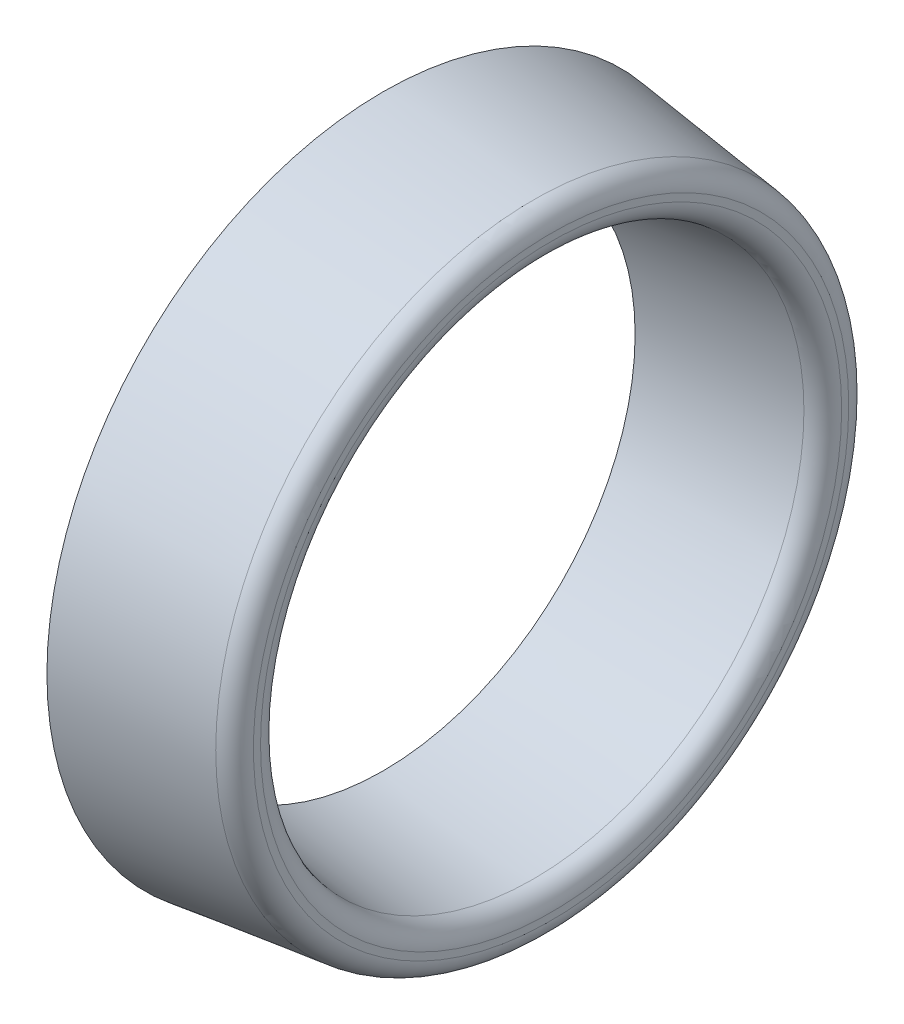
SolidWorks part; units mm, degrees
ref_plane "Front" through (0, 0, 0) normal (0, 0, 1) x (1, 0, 0)
ref_plane "Top" through (0, 0, 0) normal (0, 1, 0) x (1, 0, 0)
ref_plane "Right" through (0, 0, 0) normal (1, 0, 0) x (0, 0, -1)
sketch "Sketch1" plane through (0, 0, 0) normal (1, 0, 0) x (0, 0, -1)
  circle A0 centre (0, 0) radius 6.35
  circle A1 centre (0, 0) radius 4.7625
  dimension "D1" = 12.7
  dimension "D2" = 9.525
extrude "Base-Extrude" add sketch "Sketch1" along normal blind 3.175 draft 7
fillet "Fillet1" radius 0.381 2 edges at (3.175, 0, -5.9602) (3.175, 0, -5.1523)
shell "Shell1" thickness 0.381
